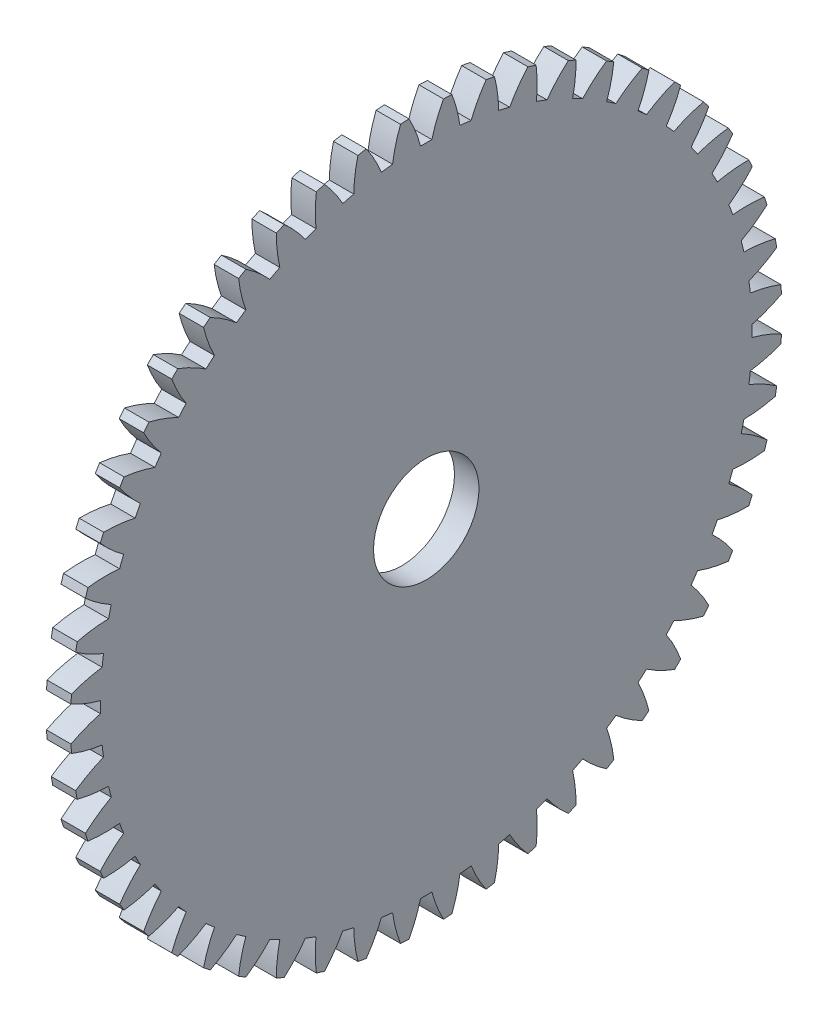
SolidWorks part; units mm, degrees
ref_plane "Plane1" through (0, 0, 0) normal (0, 0, 1) x (1, 0, 0)
ref_plane "Plane2" through (0, 0, 0) normal (0, 1, 0) x (1, 0, 0)
ref_plane "Plane3" through (0, 0, 0) normal (1, 0, 0) x (0, 0, -1)
other "Configuration Table"
sketch "HoldingSke" plane through (0, 0, 0) normal (0, 1, 0) x (1, 0, 0)
  line L0 (0, 0) -> (500.4096, -640.4951)
  line L1 (-15, 0) -> (100, 0) construction
  line L2 (0, 0) -> (-2.1039, 2.3779)
  line L3 (0, 0) -> (-11.863, 4.5341)
  line L4 (0, 0) -> (5.3169, 6.8053)
  line L5 (0, 0) -> (-47.5972, -17.7524)
  line L6 (0, 0) -> (-1.2212, -0.824)
  line L7 (-2.1039, 2.3779) -> (8.8308, 51.9871)
  line L8 (-76.2, 54.61) -> (-69.596, 54.61)
  line L9 (-71.009, 38.7566) -> (-53.1078, 45.2721)
  line L10 (-76.2, 71.12) -> (104.1128, 71.12)
  line L11 (0, 0) -> (-1.4732, 0)
  line L12 (-76.2, 101.6) -> (-76.1716, 101.6)
  line L13 (24.9733, 27.94) -> (52.9518, 28.4284)
  line L14 (24.9733, 27.94) -> (25.0241, 27.9398)
  line L15 (24.9733, 27.94) -> (100.4021, 29.52)
  circle A0 centre (0, 0) radius 3.175
  circle A1 centre (0, 0) radius 19.6342
  circle A2 centre (0, 0) radius 38.1
  circle A3 centre (0, 0) radius 3.175
sketch "BasProSke" plane through (0, 0, 0) normal (0, 1, 0) x (1, 0, 0)
  line L0 (-10, 0) -> (60, 0) construction
  line L1 (0, 0) -> (0, 21.4312)
  line L2 (0, 0) -> (1.4732, 0)
  line L3 (1.4732, 0) -> (1.4732, 21.4312)
  line L4 (1.4732, 21.4312) -> (0, 21.4312)
revolve "Base-Revolve" add sketch "BasProSke" angle 360 about L0
sketch "TooCutSke" plane through (0, 0, 0) normal (1, 0, 0) x (0, 0, -1)
  line L1 (0, 0) -> (0, 107) construction
  line L2 (0, 0) -> (-0.6731, 20.6265) construction
  line L3 (0, 0) -> (-2.4912, 41.1838) construction
  line L4 (-0.6731, 20.6265) -> (-1.2456, 20.5919) construction
  arc A0 (0.3404, 19.6312) -> (-0.3404, 19.6312) centre (0, 0) ccw
  arc A1 (1.0518, 21.4309) -> (-1.0518, 21.4309) centre (0, 0) ccw
  circle A2 centre (0, 0) radius 20.6375 construction
  circle A3 centre (0, 0) radius 19.3929 construction
  arc A4 (-0.3404, 19.6312) -> (-1.0518, 21.4309) centre (-8.3202, 17.5174) ccw
  arc A5 (1.0518, 21.4309) -> (0.3404, 19.6312) centre (8.3202, 17.5174) ccw
extrude "ToothCut" cut sketch "TooCutSke" along normal through all
fillet "Breaks" [suppressed] radius 0.0159
fillet "RootFillets" [suppressed] radius 0.2095
pattern_circular "TeethCuts" count 52 every 6.923 about axis through (-10, 0, 0) along (1, 0, 0) of "ToothCut"
sketch "HubNeaOneSke" plane through (0, 0, 0) normal (-1, 0, 0) x (0, 0, 1)
  circle A0 centre (0, 0) radius 19.6342
extrude "HubNearOne" [suppressed] add sketch "HubNeaOneSke" along normal blind 49.3269
sketch "HubNeaBotSke" plane through (0, 0, 0) normal (-1, 0, 0) x (0, 0, 1)
  circle A0 centre (0, 0) radius 19.6342
extrude "HubNearBoth" [suppressed] add sketch "HubNeaBotSke" along normal blind 24.6634
ref_plane "FarPln" through (1.4732, 0, 0) normal (1, 0, 0) x (0, 0, -1)
sketch "HubFarSke" plane through (1.4732, 0, 0) normal (1, 0, 0) x (0, 0, -1)
  circle A0 centre (0, 0) radius 19.6342
extrude "HubFar" [suppressed] add sketch "HubFarSke" along normal blind 24.6634
sketch "BorSke" plane through (0, 0, 0) normal (1, 0, 0) x (0, 0, -1)
  circle A0 centre (0, 0) radius 3.175
extrude "Bore" cut sketch "BorSke" along normal mid plane 101.6001
sketch "KeySke" plane through (0, 0, 0) normal (1, 0, 0) x (0, 0, -1)
  line L0 (-0.127, 0) -> (-0.127, 3.429)
  line L1 (-0.127, 3.429) -> (0.127, 3.429)
  line L2 (0.127, 3.429) -> (0.127, 0)
  line L3 (0, 0) -> (0, 34) construction
  line L4 (-0.127, 0) -> (0.127, 0)
extrude "Keyway" [suppressed] cut sketch "KeySke" along normal mid plane 101.6001
pattern_circular "Keyway2" [suppressed] count 2 every 90 about axis through (-10, 0, 0) along (1, 0, 0)
equation "' \"Pitch@HoldingSke\" = 4"
equation "' \"Num_teeth@HoldingSke\" = 12"
equation "' \"Ap@HoldingSke\" =  20"
equation "' \"Ap@HoldingSke\" = 20"
equation "' \"Width@HoldingSke\" = 0.5"
equation "' \"Hub_dia@HoldingSke\"= 1"
equation "' \"Hub_dia@HoldingSke\" = 1"
equation "' \"Overall_len@HoldingSke\" = 1.0"
equation "' \"Bore@HoldingSke\" = 0.75"
equation "' \"T_dim@HoldingSke\" = 0.85"
equation "' \"Width@KeySke\" = 0.25"
equation "' \"Show_teeth@HoldingSke\" = 13"
equation "' \"Backlash@HoldingSke\" = 0.009"
equation "' \"Addendum_fac@HoldingSke\" = 1.0"
equation "' \"Dedendum_fac@HoldingSke\" = 1.25"
equation "' \"Dedendum_add@HoldingSke\" = 0.00005"
equation "' \"Clearance_fac@HoldingSke\" = 0.25"
equation "' \"Pitch@HoldingSke\" = 0.5"
equation "' \"Num_teeth@HoldingSke\" = 23"
equation "' \"Show_teeth@HoldingSke\" = 23"
equation "' \"Backlash@HoldingSke\" = 0.0375"
equation "\"Overcut_dia@TooCutSke\" = (\"Num_teeth@HoldingSke\" + 2 * \"Addendum_fac@HoldingSke\") / \"Pitch@HoldingSke\" + 0.002"
equation "\"Pitch_dia@TooCutSke\" = \"Num_teeth@HoldingSke\" / \"Pitch@HoldingSke\""
equation "\"Base_dia@TooCutSke\" = \"Num_teeth@HoldingSke\" / \"Pitch@HoldingSke\" * cos((\"Ap@HoldingSke\"  * 3.14159265 / 180))"
equation "\"Root_dia@TooCutSke\" = (\"Num_teeth@HoldingSke\" + 2) / \"Pitch@HoldingSke\" - 2 * (\"Addendum_fac@HoldingSke\" + \"Dedendum_fac@HoldingSke\") / \"Pitch@HoldingSke\" - \"Dedendum_add@HoldingSke\" * 2"
equation "\"Half_ang@TooCutSke\" = 180 / \"Num_teeth@HoldingSke\""
equation "\"Half_CT@TooCutSke\" = \"Num_teeth@HoldingSke\" / \"Pitch@HoldingSke\" * sin((3.14159265 / 2 / \"Num_teeth@HoldingSke\")) / 2 - 7 * \"Backlash@HoldingSke\" / 4"
equation "\"Flank_rad@TooCutSke\" = \"Num_teeth@HoldingSke\" / \"Pitch@HoldingSke\" / 5"
equation "\"Radius@RootFillets\" = \"Clearance_fac@HoldingSke\" / \"Pitch@HoldingSke\" + \"Dedendum_add@HoldingSke\""
equation "\"Break_rad@Breaks\" = 0.02 / \"Pitch@HoldingSke\""
equation "\"Thickness@HoldingSke\" = \"Width@HoldingSke\""
equation "\"OAL@HoldingSke\" = \"Thickness@HoldingSke\""
equation "\"MHD@HoldingSke\" = (\"Num_teeth@HoldingSke\" + 2) / \"Pitch@HoldingSke\" - 2 * (\"Addendum_fac@HoldingSke\" + \"Dedendum_fac@HoldingSke\")  / \"Pitch@HoldingSke\" - \"Dedendum_add@HoldingSke\" * 2"
equation "\"MBD@HoldingSke\" = (\"Num_teeth@HoldingSke\" + 2) / \"Pitch@HoldingSke\" - 2 * (\"Addendum_fac@HoldingSke\" + \"Dedendum_fac@HoldingSke\")  / \"Pitch@HoldingSke\" - \"Dedendum_add@HoldingSke\" * 2 - 0.002"
equation "\"MHD@HoldingSke\" = ((sgn( \"MHD@HoldingSke\" - \"Hub_dia@HoldingSke\" )-1)*( \"MHD@HoldingSke\" - \"Hub_dia@HoldingSke\" ))/-2+ \"Hub_dia@HoldingSke\""
equation "\"MBD@HoldingSke\" = ((sgn( \"MBD@HoldingSke\" - \"Bore@HoldingSke\" )-1)*( \"MBD@HoldingSke\" - \"Bore@HoldingSke\" ))/-2+ \"Bore@HoldingSke\""
equation "\"OAL@HoldingSke\" = ((sgn( \"OAL@HoldingSke\" - \"Overall_len@HoldingSke\" )+1)*( \"OAL@HoldingSke\" - \"Overall_len@HoldingSke\" ))/2 + \"Overall_len@HoldingSke\" + 0.000002"
equation "\"Num_teeth@TeethCuts\" = int( \"Show_teeth@HoldingSke\" ) + 1"
equation "\"Num_teeth@TeethCuts\" = ((sgn( \"Num_teeth@TeethCuts\" - \"Num_teeth@HoldingSke\" )-1)*( \"Num_teeth@TeethCuts\" - \"Num_teeth@HoldingSke\" ))/-2+ \"Num_teeth@HoldingSke\""
equation "\"Num_teeth@TeethCuts\" = ((sgn( \"Num_teeth@TeethCuts\" - 2.0)+1)*( \"Num_teeth@TeethCuts\" - 2.0))/2 +2.0"
equation "\"Angle@TeethCuts\" = 360.0 / \"Num_teeth@HoldingSke\""
equation "\"Diameter@BasProSke\" = (\"Num_teeth@HoldingSke\" + 2 * \"Addendum_fac@HoldingSke\") / \"Pitch@HoldingSke\""
equation "\"Thickness@BasProSke\"  = \"Thickness@HoldingSke\""
equation "' \"Fillet_rad@BasProSke\" =  \"Thickness@HoldingSke\" * 0.05"
equation "' \"Fillet_rad@BasProSke\" = \"Thickness@HoldingSke\" * 0.05"
equation "\"MHD@HoldingSke\" = ((sgn( \"MHD@HoldingSke\" - \"Root_dia@TooCutSke\" )-1)*( \"MHD@HoldingSke\" - \"Root_dia@TooCutSke\" ))/-2+ \"Root_dia@TooCutSke\""
equation "\"Diameter@HubNeaOneSke\" = \"MHD@HoldingSke\""
equation "\"Length@HubNearOne\" = \"OAL@HoldingSke\" - \"Thickness@BasProSke\""
equation "\"Diameter@HubNeaBotSke\" = \"MHD@HoldingSke\""
equation "\"Length@HubNearBoth\" = ( \"OAL@HoldingSke\" - \"Thickness@BasProSke\" ) / 2.0"
equation "\"Thickness@FarPln\" = \"Thickness@BasProSke\""
equation "\"Diameter@HubFarSke\" = \"MHD@HoldingSke\""
equation "\"Length@HubFar\" = ( \"OAL@HoldingSke\" - \"Thickness@BasProSke\" ) / 2.0"
equation "\"Diameter@BorSke\" = \"MBD@HoldingSke\""
equation "\"D1@Bore\" = \"OAL@HoldingSke\" * 2.0"
equation "\"D1@Keyway\" = \"OAL@HoldingSke\" * 2.0"
equation "\"Offset@KeySke\" = \"T_dim@HoldingSke\" - \"MBD@HoldingSke\" / 2.0"
